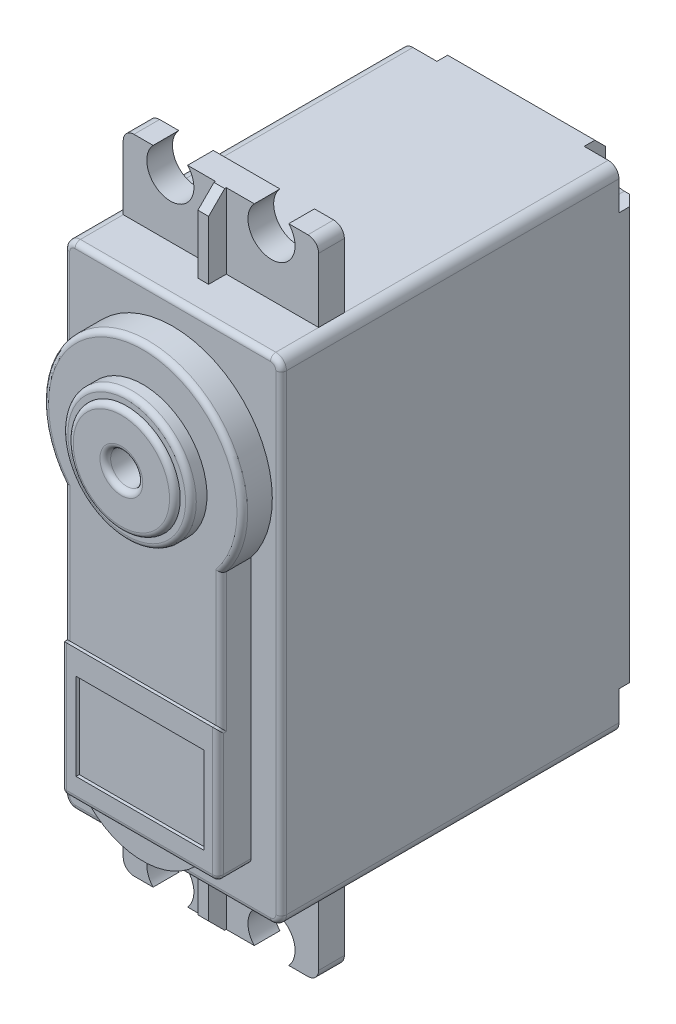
SolidWorks part; units mm, degrees
ref_plane "Face" through (0, 0, 0) normal (0, 0, 1) x (1, 0, 0)
ref_plane "Dessus" through (0, 0, 0) normal (0, 1, 0) x (1, 0, 0)
ref_plane "Droite" through (0, 0, 0) normal (1, 0, 0) x (0, 0, -1)
sketch "Esquisse1" plane through (0, 0, 0) normal (0, 0, 1) x (1, 0, 0)
  line L1 (-20.25, 31.4611) -> (0, 31.4611)
  line L2 (-20.25, 31.4611) -> (-20.25, -14.5389)
  line L3 (-20.25, -14.5389) -> (0, -14.5389)
  line L4 (0, 31.4611) -> (0, -14.5389)
  dimension "D1" = 20.25
  dimension "D2" = 46
extrude "Extrusion1" add sketch "Esquisse1" along normal blind 31.55
fillet "Congé1" radius 1 4 edges at (-20.25, -14.5389, 15.775) (0, -14.5389, 15.775) (0, 31.4611, 15.775) (-20.25, 31.4611, 15.775)
sketch "Esquisse2" plane through (0, 0, 0) normal (0, 0, -1) x (-1, 0, 0)
  line L0 (1.5, 29.4611) -> (18.75, 29.4611) construction
  line L1 (18.75, 29.4611) -> (18.75, -12.5389) construction
  line L2 (18.75, -12.5389) -> (1.5, -12.5389) construction
  line L3 (1.5, -12.5389) -> (1.5, 29.4611) construction
  line L4 (0, -13.5389) -> (0, 30.4611) construction
  line L5 (20.25, 30.4611) -> (20.25, -13.5389) construction
  line L6 (1, 31.4611) -> (19.25, 31.4611) construction
  line L7 (19.25, -14.5389) -> (1, -14.5389) construction
  line L8 (3.25, 29.4611) -> (3.25, 31.4611)
  line L9 (3.25, 31.4611) -> (17, 31.4611)
  line L10 (17, 31.4611) -> (17, 29.4611)
  line L11 (18.75, 27.7111) -> (20.25, 27.7111)
  line L12 (20.25, 27.7111) -> (20.25, -10.7889)
  line L13 (20.25, -10.7889) -> (18.75, -10.7889)
  line L14 (17, -12.5389) -> (17, -14.5389)
  line L15 (17, -14.5389) -> (3.25, -14.5389)
  line L16 (3.25, -14.5389) -> (3.25, -12.5389)
  line L17 (1.5, -10.7889) -> (0, -10.7889)
  line L18 (0, -10.7889) -> (0, 27.7111)
  line L19 (0, 27.7111) -> (1.5, 27.7111)
  arc A0 (1.5, 27.7111) -> (3.25, 29.4611) centre (1.5, 29.4611) ccw
  arc A1 (17, 29.4611) -> (18.75, 27.7111) centre (18.75, 29.4611) ccw
  arc A2 (18.75, -10.7889) -> (17, -12.5389) centre (18.75, -12.5389) ccw
  arc A3 (3.25, -12.5389) -> (1.5, -10.7889) centre (1.5, -12.5389) ccw
  dimension "D5" = 1.75
  dimension "D1" = 1.5
  dimension "D2" = 1.5
  dimension "D3" = 2
  dimension "D4" = 2
extrude "Extrusion2" add sketch "Esquisse2" along normal blind 2
chamfer "Chanfrein1" distance 1 angle 45 4 edges at (-10.125, 31.4611, -2) (-10.125, -14.5389, -2) (0, 8.4611, -2) (-20.25, 8.4611, -2)
sketch "Esquisse3" plane through (0, 0, 31.55) normal (0, 0, 1) x (1, 0, 0)
  line L0 (-10.125, 31.4611) -> (-10.125, -14.5389) construction
  line L1 (-1, 31.4611) -> (-19.25, 31.4611) construction
  line L2 (-19.25, -14.5389) -> (-1, -14.5389) construction
  line L4 (-17.4428, -10.6524) -> (-14.9696, -10.6524)
  line L5 (-17.4428, -10.6524) -> (-17.4428, 14.2118)
  line L7 (-2.8072, -10.6524) -> (-2.8072, 14.2118)
  line L8 (-5.2804, -10.6524) -> (-2.8072, -10.6524)
  arc A0 (-17.4428, 14.2118) -> (-2.8072, 14.2118) centre (-10.125, 19.9511) cw
  arc A1 (-14.9696, -10.6524) -> (-5.2804, -10.6524) centre (-10.125, -5.655) ccw
  dimension "D1" = 9.3
extrude "Extrusion3" add sketch "Esquisse3" along normal blind 2.8
sketch "Esquisse4" plane through (0, 0, 34.35) normal (0, 0, 1) x (1, 0, 0)
  line L0 (-2.8072, -10.6524) -> (-2.8072, 14.2118) construction
  line L1 (-17.4428, -10.6524) -> (-2.8072, -10.6524)
  line L2 (-17.4428, -10.6524) -> (-17.4428, 1.7797)
  line L3 (-17.4428, 1.7797) -> (-2.8072, 1.7797)
  line L4 (-2.8072, -10.6524) -> (-2.8072, 1.7797)
extrude "Extrusion4" add sketch "Esquisse4" along normal blind 0.3
sketch "Esquisse5" plane through (0, 0, 34.65) normal (0, 0, 1) x (1, 0, 0)
  line L1 (-16.0571, -0.4748) -> (-4.0939, -0.4748)
  line L2 (-16.0571, -0.4748) -> (-16.0571, -8.5821)
  line L3 (-16.0571, -8.5821) -> (-4.0939, -8.5821)
  line L4 (-4.0939, -0.4748) -> (-4.0939, -8.5821)
extrude "Enlèv. mat.-Extru.1" cut sketch "Esquisse5" against normal blind 0.3
sketch "Esquisse6" plane through (0, 0, 34.35) normal (0, 0, 1) x (1, 0, 0)
  circle A0 centre (-10.125, 19.9511) radius 6
  arc A1 (-2.8072, 14.2118) -> (-17.4428, 14.2118) centre (-10.125, 19.9511) ccw construction
  dimension "D1" = 12
extrude "Extrusion5" add sketch "Esquisse6" along normal blind 1.5
sketch "Esquisse7" plane through (0, 0, 35.85) normal (0, 0, 1) x (1, 0, 0)
  circle A0 centre (-10.125, 19.9511) radius 5
  circle A1 centre (-10.125, 19.9511) radius 6 construction
  dimension "D1" = 10
extrude "Extrusion6" add sketch "Esquisse7" along normal blind 0.5
sketch "Esquisse8" plane through (0, 0, 36.35) normal (0, 0, 1) x (1, 0, 0)
  circle A0 centre (-10.125, 19.9511) radius 1.5
  circle A1 centre (-10.125, 19.9511) radius 5 construction
  dimension "D1" = 3
extrude "Enlèv. mat.-Extru.2" cut sketch "Esquisse8" against normal blind 10
fillet "Congé2" radius 0.5 21 edges at (-19.9571, -14.246, 31.55) (-20.25, 8.4611, 31.55) (-19.9571, 31.1682, 31.55) (-10.125, 31.4611, 31.55) (-0.2929, 31.1682, 31.55) (0, 8.4611, 31.55) (-0.2929, -14.246, 31.55) (-8.625, 19.9511, 36.35) (-5.125, 19.9511, 36.35) (-4.125, 19.9511, 35.85) (-10.125, -10.6524, 34.65) (-2.8072, -4.4364, 34.65) (-17.4428, -4.4364, 34.65) (-10.125, 29.2511, 34.35) (-2.8072, -10.6524, 33.1) (-17.4428, -10.6524, 33.1) (-10.125, -14.5389, 31.55)
sketch "Esquisse9" plane through (0, 31.4611, 0) normal (0, 1, 0) x (-1, 0, 0)
  line L0 (1, 31.05) -> (1, 0) construction
  line L1 (1, 27.05) -> (19.25, 27.05)
  line L2 (1, 27.05) -> (1, 24.65)
  line L3 (1, 24.65) -> (19.25, 24.65)
  line L4 (19.25, 27.05) -> (19.25, 24.65)
  line L5 (19.25, 0) -> (19.25, 31.05) construction
  line L6 (1, 31.55) -> (19.25, 31.55) construction
  dimension "D1" = 2.4
  dimension "D2" = 4.5
extrude "Extrusion7" add sketch "Esquisse9" along normal blind 7
sketch "Esquisse10" plane through (0, -14.5389, 0) normal (0, -1, 0) x (1, 0, 0)
  line L0 (-19.25, 31.05) -> (-19.25, 0) construction
  line L1 (-19.25, 27.05) -> (-1, 27.05)
  line L2 (-19.25, 27.05) -> (-19.25, 24.65)
  line L3 (-19.25, 24.65) -> (-1, 24.65)
  line L4 (-1, 27.05) -> (-1, 24.65)
  line L5 (-1, 0) -> (-1, 31.05) construction
  line L6 (-19.25, 31.55) -> (-1, 31.55) construction
  dimension "D1" = 4.5
  dimension "D2" = 2.4
extrude "Extrusion8" add sketch "Esquisse10" along normal blind 7
sketch "Esquisse11" plane through (0, 0, 34.35) normal (0, 0, 1) x (1, 0, 0)
  line L0 (-10.125, 38.4611) -> (-10.125, -21.5389) construction
  line L1 (-19.25, 38.4611) -> (-1, 38.4611) construction
  line L2 (-1, -21.5389) -> (-19.25, -21.5389) construction
  line L3 (-19.25, 36.9611) -> (-1, 36.9611) construction
  line L4 (-19.25, 38.4611) -> (-19.25, 31.4611) construction
  line L5 (-1, 38.4611) -> (-1, 31.4611) construction
  line L6 (-19.25, -20.0389) -> (-1, -20.0389) construction
  line L7 (-19.25, -21.5389) -> (-19.25, -14.5389) construction
  line L8 (-1, -21.5389) -> (-1, -14.5389) construction
  circle A0 centre (-14.85, 36.9611) radius 2.2
  circle A1 centre (-5.4, 36.9611) radius 2.2
  circle A2 centre (-14.85, -20.0389) radius 2.2
  circle A3 centre (-5.4, -20.0389) radius 2.2
  dimension "D3" = 4.4
  dimension "D1" = 1.5
  dimension "D2" = 1.5
  dimension "D4" = 9.45
  dimension "D5" = 9.45
extrude "Enlèv. mat.-Extru.3" cut sketch "Esquisse11" against normal through all
fillet "Congé3" radius 1 4 edges at (-19.25, -21.5389, 25.85) (-1, -21.5389, 25.85) (-1, 38.4611, 25.85) (-19.25, 38.4611, 25.85)
sketch "Esquisse12" plane through (0, 0, 27.05) normal (0, 0, 1) x (1, 0, 0)
  line L0 (-10.125, 38.4611) -> (-10.125, -21.5389) construction
  line L1 (-13.2407, 38.4611) -> (-7.0093, 38.4611) construction
  line L2 (-7.0093, -21.5389) -> (-13.2407, -21.5389) construction
  line L3 (-19.25, 31.4611) -> (-1, 31.4611) construction
  line L4 (-10.625, 38.4611) -> (-9.625, 38.4611)
  line L5 (-10.625, 38.4611) -> (-10.625, 31.4611)
  line L6 (-10.625, 31.4611) -> (-9.625, 31.4611)
  line L7 (-9.625, 38.4611) -> (-9.625, 31.4611)
  line L8 (-1, -14.5389) -> (-19.25, -14.5389) construction
  line L9 (-10.625, -14.5389) -> (-9.625, -14.5389)
  line L10 (-10.625, -14.5389) -> (-10.625, -21.5389)
  line L11 (-10.625, -21.5389) -> (-9.625, -21.5389)
  line L12 (-9.625, -14.5389) -> (-9.625, -21.5389)
  dimension "D1" = 1
  dimension "D2" = 1
extrude "Extrusion9" add sketch "Esquisse12" along normal blind 1.65
chamfer "Chanfrein2" distance 1.5 angle 45 2 edges at (-10.125, 38.4611, 28.7) (-10.125, -21.5389, 28.7)
